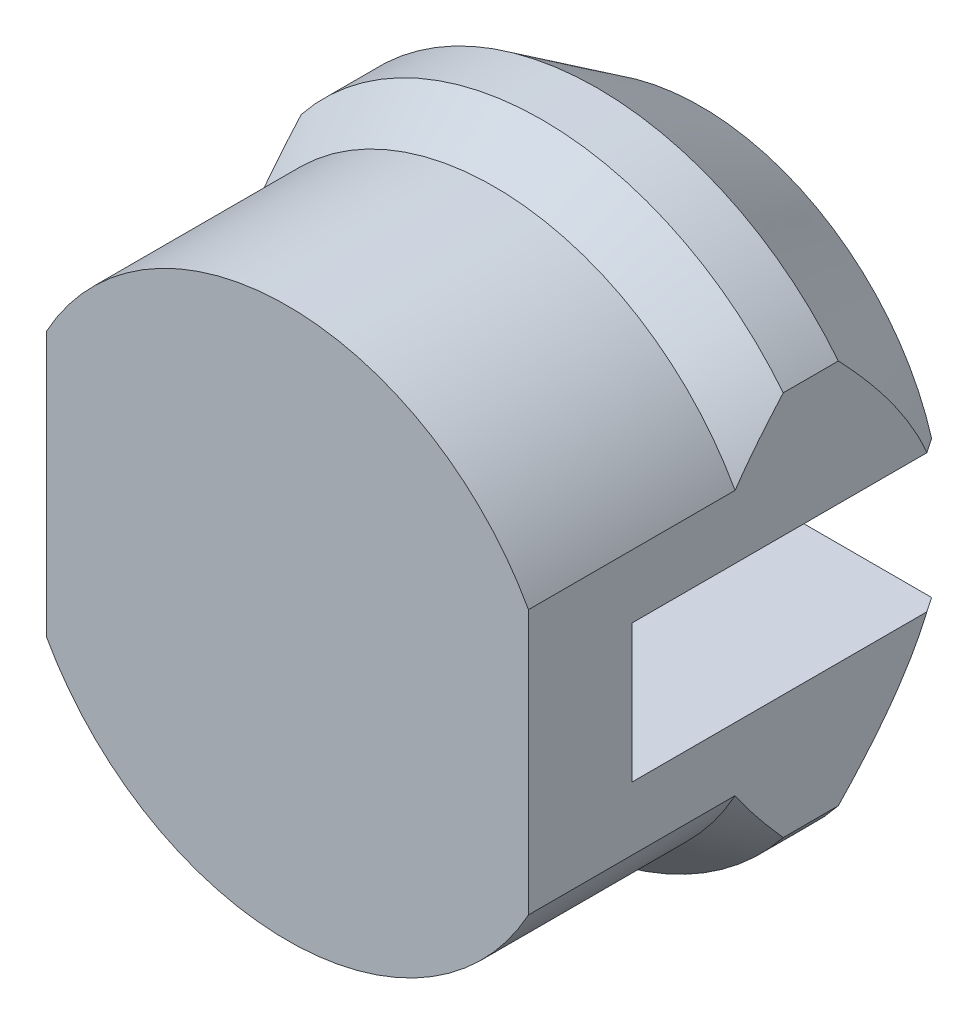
SolidWorks part; units mm, degrees
ref_plane "Front Plane" through (0, 0, 0) normal (0, 0, 1) x (1, 0, 0)
ref_plane "Top Plane" through (0, 0, 0) normal (0, 1, 0) x (1, 0, 0)
ref_plane "Right Plane" through (0, 0, 0) normal (1, 0, 0) x (0, 0, -1)
sketch "Sketch7" plane through (0, 0, 0) normal (0, 1, 0) x (1, 0, 0)
  line L0 (3.5, 6) -> (1.589, 6)
  line L1 (1.589, 6) -> (1.589, 1.5)
  line L2 (1.589, 1.5) -> (0, 1.5)
  line L3 (0, 1.5) -> (0, 0)
  line L4 (0, 0) -> (3.9917, 0)
  line L5 (3.9917, 0) -> (3.9917, 3)
  line L6 (3.9917, 3) -> (4.4801, 3.7)
  line L7 (4.4801, 3.7) -> (4.4801, 4.5)
  line L8 (4.4801, 4.5) -> (3.5, 6)
  dimension "D1" = 3.9917
  dimension "D2" = 1.911
  dimension "D3" = 4.5
  dimension "D4" = 3
  dimension "D5" = 0.8
  dimension "D6" = 1.5
  dimension "D7" = 0.7
  dimension "D8" = 4.4801
  dimension "D9" = 3.5
revolve "Revolve2" add sketch "Sketch7" angle 360 about L3
sketch "Sketch11" plane through (0, 0, 0) normal (0, 0, 1) x (1, 0, 0)
  line L0 (3.9917, 0) -> (-3.9917, 0) construction
  line L1 (0, 0) -> (0, 3.9917) construction
  line L2 (0, 0) -> (0, -3.9917) construction
  circle A0 centre (0, 0) radius 3.9917 construction
  point P0 (0, 0)
sketch "Sketch9" plane through (0, 0, -6) normal (0, 0, -1) x (-1, 0, 0)
  line L1 (4.4801, -1) -> (-4.4801, -1)
  line L2 (4.4801, -1) -> (4.4801, 1)
  line L3 (4.4801, 1) -> (-4.4801, 1)
  line L4 (-4.4801, -1) -> (-4.4801, 1)
  line L5 (4.4801, -1) -> (-4.4801, 1) construction
  line L6 (4.4801, 1) -> (-4.4801, -1) construction
  circle A0 centre (0, 0) radius 4.4801 construction
  point P0 (0, 0)
  dimension "D1" = 2
extrude "Cut-Extrude2" cut sketch "Sketch9" along direction (0, 0, 1) on the side against the normal up to surface (4.5 mm away)
sketch "Sketch10" plane through (0, 0, -6) normal (0, 0, -1) x (-1, 0, 0)
  line L0 (-3.5, 2.7966) -> (-4.4801, 2.7966)
  line L2 (3.5, -2.7966) -> (3.5, 2.7966)
  line L3 (-3.5, -2.7966) -> (-4.4801, -2.7966)
  line L4 (-3.5, -2.7966) -> (-3.5, 2.7966)
  line L5 (3.5, -2.7966) -> (-3.5, 2.7966) construction
  line L6 (3.5, 2.7966) -> (-3.5, -2.7966) construction
  line L7 (4.4801, -2.7966) -> (3.5, -2.7966)
  line L8 (4.4801, -2.7966) -> (4.4801, 2.7966)
  line L9 (4.4801, 2.7966) -> (3.5, 2.7966)
  line L10 (-4.4801, -2.7966) -> (-4.4801, 2.7966)
  arc A0 (4.367, 1) -> (-4.367, 1) centre (0, 0) ccw construction
  point P0 (0, 0)
  point P9 (0, 0)
  dimension "D1" = 7
extrude "Cut-Extrude4" cut sketch "Sketch10" against normal through all
